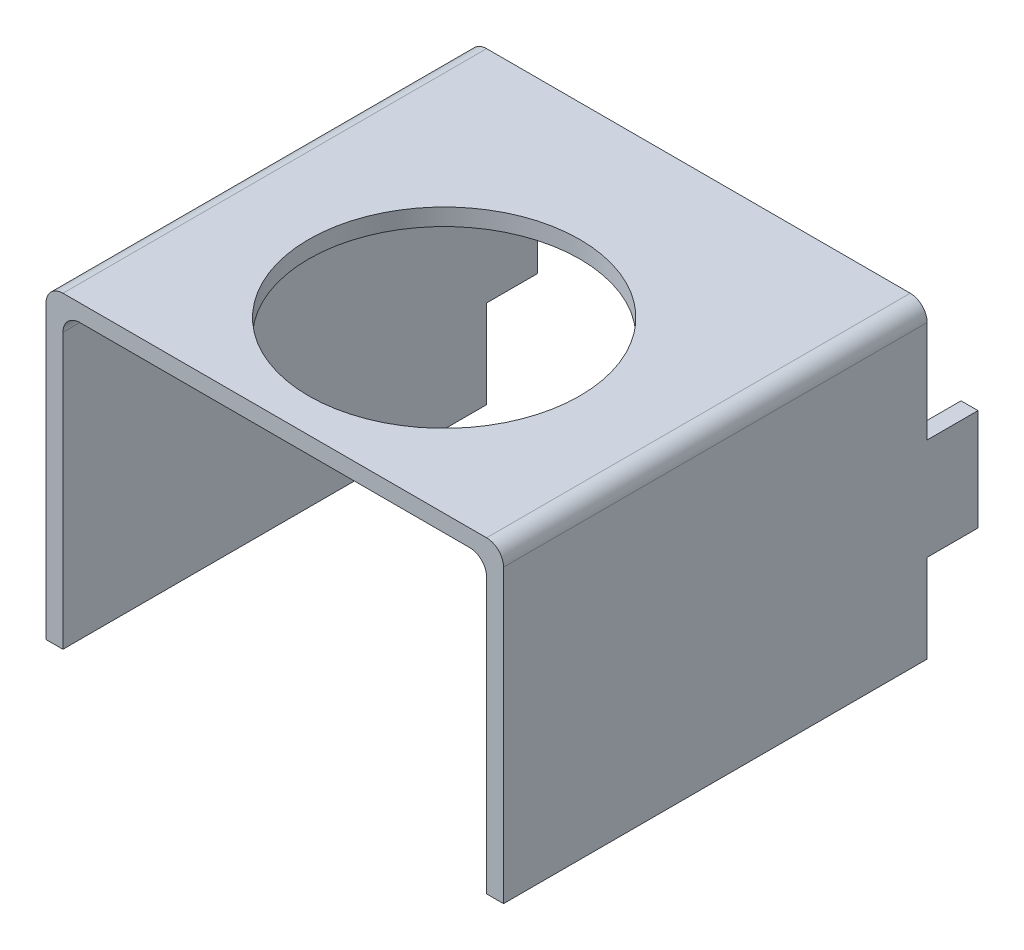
SolidWorks part; units mm, degrees
ref_plane "前视基准面" through (0, 0, 0) normal (0, 0, 1) x (1, 0, 0)
ref_plane "上视基准面" through (0, 0, 0) normal (0, 1, 0) x (1, 0, 0)
ref_plane "右视基准面" through (0, 0, 0) normal (1, 0, 0) x (0, 0, -1)
sketch "草图1" plane through (0, 0, 0) normal (0, 0, 1) x (1, 0, 0)
  line L1 (67.5, 45.5) -> (-67.5, 45.5)
  line L2 (67.5, 45.5) -> (67.5, -45.5)
  line L3 (67.5, -45.5) -> (-67.5, -45.5)
  line L4 (-67.5, 45.5) -> (-67.5, -45.5)
  line L5 (67.5, 45.5) -> (-67.5, -45.5) construction
  line L6 (67.5, -45.5) -> (-67.5, 45.5) construction
  point P0 (0, 0)
  dimension "D1" = 135
  dimension "D2" = 91
extrude "凸台-拉伸1" add sketch "草图1" along normal blind 125
shell "抽壳1" thickness 5
fillet "圆角1" radius 5 4 edges at (-62.5, 40.5, 62.5) (-67.5, 45.5, 62.5) (62.5, 40.5, 62.5) (67.5, 45.5, 62.5)
sketch "草图4" plane through (0, 45.5, 0) normal (0, 1, 0) x (1, 0, 0)
  circle A0 centre (0, -75) radius 40
  dimension "D1" = 80
  dimension "D2" = 75
extrude "切除-拉伸1" cut sketch "草图4" against normal blind 35
sketch "草图5" plane through (0, 0, 0) normal (0, 0, -1) x (-1, 0, 0)
  line L0 (62.5, 35.5) -> (62.5, -45.5) construction
  line L1 (62.5, 10.5) -> (67.5, 10.5)
  line L2 (62.5, 10.5) -> (62.5, -19.5)
  line L3 (62.5, -19.5) -> (67.5, -19.5)
  line L4 (67.5, 10.5) -> (67.5, -19.5)
  line L5 (67.5, 40.5) -> (67.5, -45.5) construction
  line L6 (-57.5, 40.5) -> (57.5, 40.5) construction
  line L7 (0, 0) -> (0, -32.7423) construction
  line L8 (-67.5, 10.5) -> (-67.5, -19.5)
  line L9 (-62.5, -19.5) -> (-67.5, -19.5)
  line L10 (-62.5, 10.5) -> (-62.5, -19.5)
  line L11 (-62.5, 10.5) -> (-67.5, 10.5)
  dimension "D1" = 30
  dimension "D2" = 30
extrude "凸台-拉伸5" add sketch "草图5" along normal blind 15
